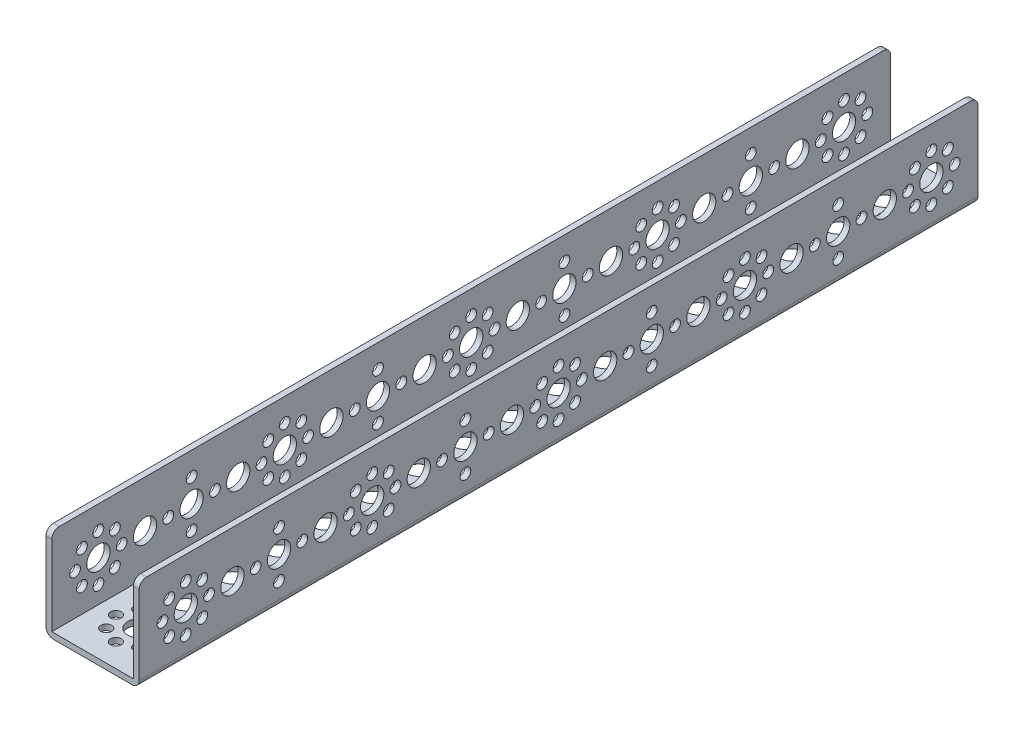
SolidWorks part; units mm, degrees
ref_plane "Front Plane" through (0, 0, 0) normal (0, 0, 1) x (1, 0, 0)
ref_plane "Top Plane" through (0, 0, 0) normal (0, 1, 0) x (1, 0, 0)
ref_plane "Right Plane" through (0, 0, 0) normal (1, 0, 0) x (0, 0, -1)
sketch "Sketch1" plane through (0, 0, 0) normal (0, 0, 1) x (1, 0, 0)
  line L0 (2.5, 0) -> (29.5, 0)
  line L1 (32, 2.5) -> (32, 32)
  line L2 (32, 32) -> (30, 32)
  line L3 (30, 32) -> (30, 2)
  line L4 (30, 2) -> (2, 2)
  line L5 (2, 2) -> (2, 32)
  line L6 (2, 32) -> (0, 32)
  line L7 (0, 32) -> (0, 2.5)
  arc A0 (0, 2.5) -> (2.5, 0) centre (2.5, 2.5) ccw
  arc A1 (32, 2.5) -> (29.5, 0) centre (29.5, 2.5) cw
  point P11 (0, 0)
  point P14 (32, 0)
  dimension "D6" = 2.5
  dimension "D1" = 32
  dimension "D2" = 2
  dimension "D3" = 2
  dimension "D4" = 32
  dimension "D5" = 2
extrude "Extrude1" add sketch "Sketch1" against normal blind 288
sketch "Sketch2"
sketch_block_instance "Block6-1"
sketch_block "Block6" parameters "D1"=16, "D2"=16, "D3"=16, "D4"=16, "D5"=16, "D6"=16, "D7"=16, "D8"=16
sketch_block_instance "Block5-1"
sketch_block "Block5"
sketch_block_instance "Block2-4"
sketch_block "Block2"
sketch_block_instance "Block5-2"
sketch_block_instance "Block2-5"
extrude "Cut-Extrude1" cut sketch "Sketch2" against normal through all
sketch "Sketch5" plane through (0, 0, 0) normal (0, -1, 0) x (1, 0, 0)
  line L0 (2.5, 0) -> (29.5, 0) construction
  line L1 (32, -288) -> (32, 0) construction
  line L2 (0, -288) -> (0, 0) construction
  dimension "D1" = 16
  dimension "D2" = 16
  dimension "D3" = 16
  dimension "D4" = 16
  dimension "D5" = 16
  dimension "D6" = 16
sketch_block_instance "Block6-3"
sketch_block_instance "Block6-11"
sketch_block_instance "Block2-10"
extrude "Cut-Extrude2" cut sketch "Sketch5" against normal up to surface (2 mm away)
fillet "Fillet1" radius 2.5 1 edges at (31, 32, 0)
fillet "Fillet2" radius 2.5 1 edges at (1, 32, 0)
fillet "Fillet3" radius 2.5 1 edges at (1, 32, -288)
fillet "Fillet4" radius 2.5 1 edges at (31, 32, -288)
sketch "Sketch7" plane through (0, 0, 0) normal (-1, 0, 0) x (0, 0, 1)
  line L0 (-285.5, 32) -> (-2.5, 32) construction
  line L1 (-288, 29.5) -> (-288, 2.5) construction
  dimension "D1" = 16
  dimension "D2" = 16
sketch_block_instance "Block6-6"
extrude "Cut-Extrude3" cut sketch "Sketch7" against normal through all
sketch "Sketch8" plane through (0, 0, 0) normal (-1, 0, 0) x (0, 0, 1)
  line L1 (-285.5, 32) -> (-2.5, 32) construction
  circle A0 centre (-160, 16) radius 4 construction
  dimension "D1" = 16
  dimension "D2" = 16
sketch_block_instance "Block2-7"
extrude "Cut-Extrude4" cut sketch "Sketch8" against normal through all
